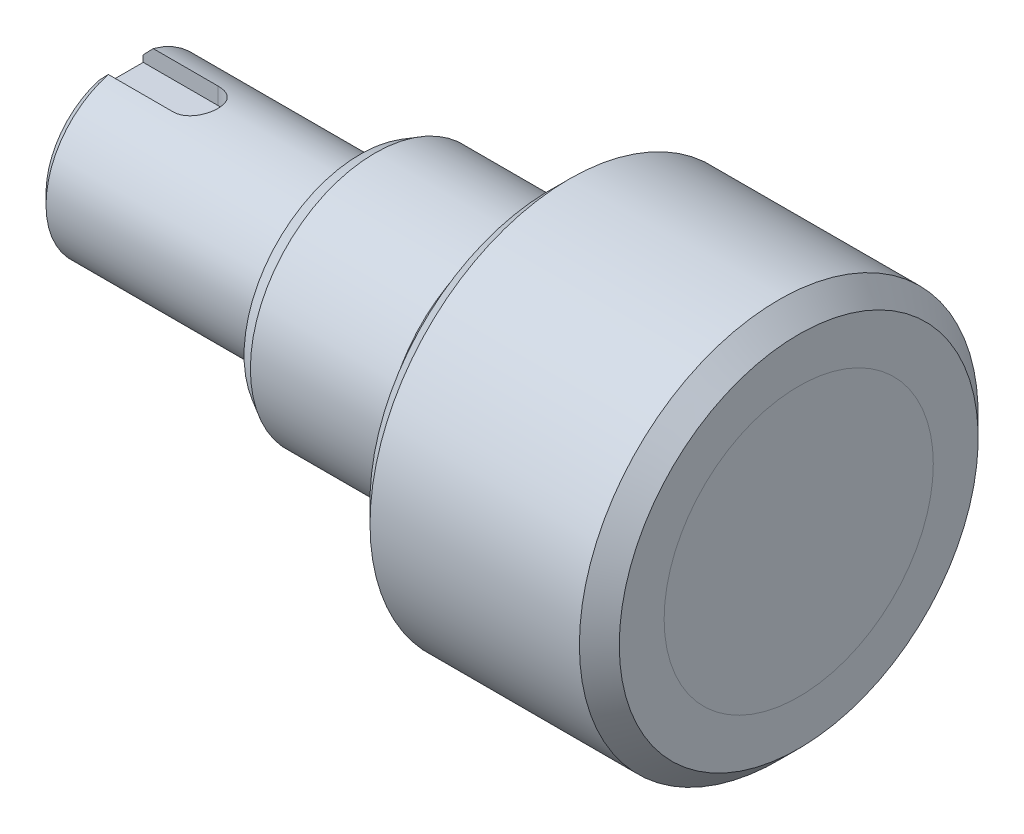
SolidWorks part; units mm, degrees
ref_plane "Face" through (0, 0, 0) normal (0, 0, 1) x (1, 0, 0)
ref_plane "Dessus" through (0, 0, 0) normal (0, 1, 0) x (1, 0, 0)
ref_plane "Droite" through (0, 0, 0) normal (1, 0, 0) x (0, 0, -1)
sketch "Esquisse1" plane through (0, 0, 0) normal (0, 0, 1) x (1, 0, 0)
  line L0 (0, 0) -> (84.5615, 0) construction
  line L1 (0, 0) -> (0, 8.5)
  line L2 (0, 8.5) -> (24, 8.5)
  line L3 (24, 8.5) -> (24, 12.5)
  line L4 (24, 12.5) -> (43, 12.5)
  line L5 (43, 12.5) -> (43, 20)
  line L6 (43, 20) -> (68, 20)
  line L7 (68, 20) -> (68, 0)
  line L8 (0, 0) -> (68, 0)
  dimension "D1" = 44
  dimension "D2" = 17
  dimension "D3" = 24
  dimension "D4" = 25
  dimension "D5" = 19
  dimension "D6" = 40
revolve "Révolution1" add sketch "Esquisse1" angle 360 about L0
sketch "Esquisse2" plane through (68, 0, 0) normal (1, 0, 0) x (0, 0, -1)
  circle A0 centre (0, 0) radius 15.625
  dimension "D1" = 31.25
extrude "Enlèv. mat.-Extru.1" cut sketch "Esquisse2" against normal blind 22
chamfer "Chanfrein1" distance 2 angle 45 2 edges at (43, 0, 20) (68, 0, 20)
sketch "Esquisse3" plane through (0, 0, 0) normal (0, 0, 1) x (1, 0, 0)
  line L0 (39, 12.5) -> (40, 11.5)
  line L1 (43, 12.5) -> (24, 12.5) construction
  line L2 (40, 11.5) -> (41, 12.5)
  line L3 (0, 0) -> (68, 0) construction
  line L4 (68, -18) -> (68, 18) construction
  line L5 (43, 18) -> (43, -18) construction
  line L6 (39, 12.5) -> (41, 12.5)
  dimension "D1" = 3
  dimension "D2" = 23
revolve "Enlèvement de matière-Révolution1" cut sketch "Esquisse3" angle 360 about L3
chamfer "Chanfrein3" distance 1 angle 45 1 edges at (0, 0, 8.5)
ref_plane "Plan1" through (0, 8.5, 0) normal (0, 1, 0) x (-1, 0, 0)
sketch "Esquisse8" plane through (0, 8.5, 0) normal (0, 1, 0) x (-1, 0, 0)
  line L0 (0, -7.5) -> (0, 7.5) construction
  line L1 (0, 2.25) -> (-7.5, 2.25)
  line L2 (0, 2.25) -> (0, -2.25)
  line L3 (0, -2.25) -> (-7.5, -2.25)
  arc A0 (-7.5, 2.25) -> (-7.5, -2.25) centre (-7.5, 0) ccw
  dimension "D1" = 4.5
  dimension "D2" = 7.5
extrude "Enlèv. mat.-Extru.2" cut sketch "Esquisse8" against normal blind 2
chamfer "Chanfrein4" distance 1.5 angle 30 1 edges at (24, 0, 12.5)
sketch "Esquisse9" plane through (0, 0, 0) normal (0, 0, 1) x (1, 0, 0)
  line L0 (43, 13.5) -> (68, 13.5)
  line L1 (43, 18) -> (43, -18) construction
  line L2 (68, -18) -> (68, 18) construction
  line L3 (0, 0) -> (68, 0) construction
  dimension "D1" = 27
surface "Surface-Révolution1" sketch "Esquisse9" parameters "D1"=360
split "Fractionner1" trim tools "Surface-Révolution1" bodies to split 107 resulting bodies 109 110
